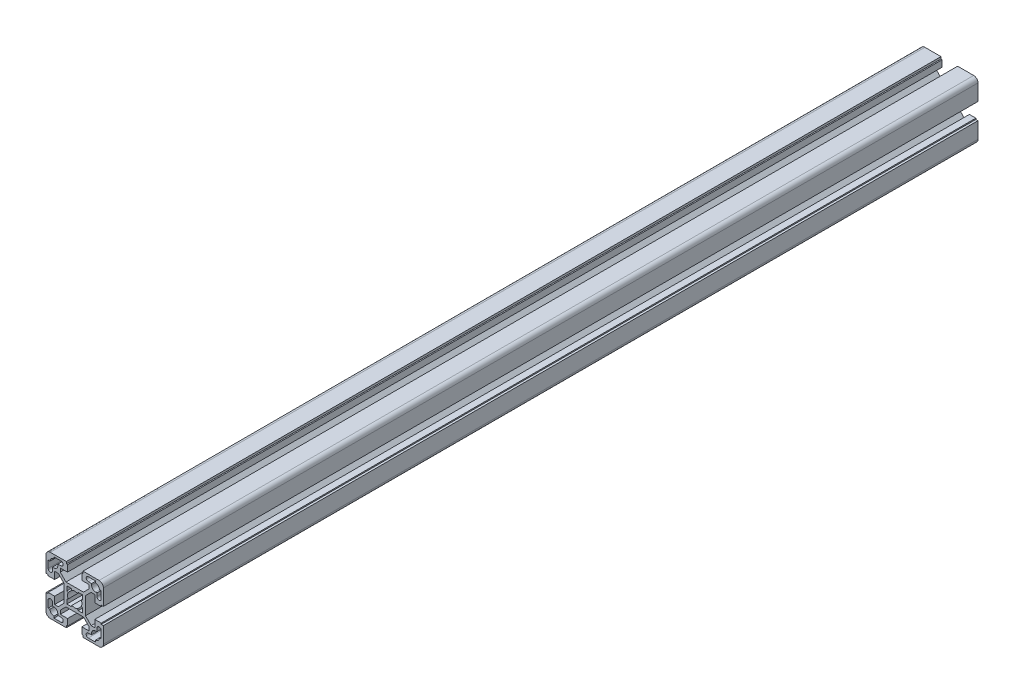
SolidWorks part; units mm, degrees
ref_plane "Front" through (0, 0, 0) normal (0, 0, 1) x (1, 0, 0)
ref_plane "Top" through (0, 0, 0) normal (0, 1, 0) x (1, 0, 0)
ref_plane "Right" through (0, 0, 0) normal (1, 0, 0) x (0, 0, -1)
ref_plane "Plane1" through (0, 0, 25) normal (0, 0, 1) x (1, 0, 0)
sketch "Sketch1" plane through (0, 0, 25) normal (0, 0, 1) x (1, 0, 0)
  line L0 (-17.25, -14.5) -> (-18.5, -14.5)
  line L1 (-18.5, -14.5) -> (-18.5, -9.5)
  line L2 (-15.5, -9.5) -> (-15.5, -11.75)
  line L3 (-15.5, -11.75) -> (-14.5, -11.75)
  line L4 (-11.75, -14.5) -> (-11.75, -15.5)
  line L5 (-11.75, -15.5) -> (-9.5, -15.5)
  line L6 (-9.5, -18.5) -> (-14.5, -18.5)
  line L7 (-14.5, -18.5) -> (-14.5, -17.25)
  line L8 (9.5, -15.5) -> (11.75, -15.5)
  line L9 (11.75, -15.5) -> (11.75, -14.5)
  line L10 (14.5, -11.75) -> (15.5, -11.75)
  line L11 (15.5, -11.75) -> (15.5, -9.5)
  line L12 (18.5, -9.5) -> (18.5, -14.5)
  line L13 (18.5, -14.5) -> (17.25, -14.5)
  line L14 (14.5, -17.25) -> (14.5, -18.5)
  line L15 (14.5, -18.5) -> (9.5, -18.5)
  line L16 (17.25, 14.5) -> (18.5, 14.5)
  line L17 (18.5, 14.5) -> (18.5, 9.5)
  line L18 (15.5, 9.5) -> (15.5, 11.75)
  line L19 (15.5, 11.75) -> (14.5, 11.75)
  line L20 (11.75, 14.5) -> (11.75, 15.5)
  line L21 (11.75, 15.5) -> (9.5, 15.5)
  line L22 (9.5, 18.5) -> (14.5, 18.5)
  line L23 (14.5, 18.5) -> (14.5, 17.25)
  line L24 (-9.5, 15.5) -> (-11.75, 15.5)
  line L25 (-11.75, 15.5) -> (-11.75, 14.5)
  line L26 (-14.5, 11.75) -> (-15.5, 11.75)
  line L27 (-15.5, 11.75) -> (-15.5, 9.5)
  line L28 (-18.5, 9.5) -> (-18.5, 14.5)
  line L29 (-18.5, 14.5) -> (-17.25, 14.5)
  line L30 (-14.5, 17.25) -> (-14.5, 18.5)
  line L31 (-14.5, 18.5) -> (-9.5, 18.5)
  line L32 (-2.3979, -5.5) -> (-5.5, -5.5)
  line L33 (-5.5, -5.5) -> (-5.5, -2.3979)
  line L34 (-5.5, -2.3979) -> (-4.5833, -1.9983)
  line L35 (-4.5833, 1.9983) -> (-5.5, 2.3979)
  line L36 (-5.5, 2.3979) -> (-5.5, 5.5)
  line L37 (-5.5, 5.5) -> (-2.3979, 5.5)
  line L38 (-2.3979, 5.5) -> (-1.9983, 4.5833)
  line L39 (1.9983, 4.5833) -> (2.3979, 5.5)
  line L40 (2.3979, 5.5) -> (5.5, 5.5)
  line L41 (5.5, 5.5) -> (5.5, 2.3979)
  line L42 (5.5, 2.3979) -> (4.5833, 1.9983)
  line L43 (4.5833, -1.9983) -> (5.5, -2.3979)
  line L44 (5.5, -2.3979) -> (5.5, -5.5)
  line L45 (5.5, -5.5) -> (2.3979, -5.5)
  line L46 (2.3979, -5.5) -> (1.9983, -4.5833)
  line L47 (-1.9983, -4.5833) -> (-2.3979, -5.5)
  line L48 (10.05, -11.4642) -> (10.05, -14)
  line L49 (10.05, -14) -> (5, -14)
  line L50 (5, -14) -> (5, -18.5)
  line L51 (5, -18.5) -> (5.8, -18.5)
  line L52 (5.8, -18.5) -> (5.8, -20)
  line L53 (5.8, -20) -> (17, -20)
  line L54 (20, -17) -> (20, -5.8)
  line L55 (20, -5.8) -> (18.5, -5.8)
  line L56 (18.5, -5.8) -> (18.5, -5)
  line L57 (18.5, -5) -> (14, -5)
  line L58 (14, -5) -> (14, -10.05)
  line L59 (14, -10.05) -> (11.4642, -10.05)
  line L60 (11.4642, -10.05) -> (7.5, -6.0858)
  line L61 (7.5, -6.0858) -> (7.5, 6.0858)
  line L62 (7.5, 6.0858) -> (11.4642, 10.05)
  line L63 (11.4642, 10.05) -> (14, 10.05)
  line L64 (14, 10.05) -> (14, 5)
  line L65 (14, 5) -> (18.5, 5)
  line L66 (18.5, 5) -> (18.5, 5.8)
  line L67 (18.5, 5.8) -> (20, 5.8)
  line L68 (20, 5.8) -> (20, 17)
  line L69 (17, 20) -> (5.8, 20)
  line L70 (5.8, 20) -> (5.8, 18.5)
  line L71 (5.8, 18.5) -> (5, 18.5)
  line L72 (5, 18.5) -> (5, 14)
  line L73 (5, 14) -> (10.05, 14)
  line L74 (10.05, 14) -> (10.05, 11.4642)
  line L75 (10.05, 11.4642) -> (6.0858, 7.5)
  line L76 (6.0858, 7.5) -> (-6.0858, 7.5)
  line L77 (-6.0858, 7.5) -> (-10.05, 11.4642)
  line L78 (-10.05, 11.4642) -> (-10.05, 14)
  line L79 (-10.05, 14) -> (-5, 14)
  line L80 (-5, 14) -> (-5, 18.5)
  line L81 (-5, 18.5) -> (-5.8, 18.5)
  line L82 (-5.8, 18.5) -> (-5.8, 20)
  line L83 (-5.8, 20) -> (-17, 20)
  line L84 (-20, 17) -> (-20, 5.8)
  line L85 (-20, 5.8) -> (-18.5, 5.8)
  line L86 (-18.5, 5.8) -> (-18.5, 5)
  line L87 (-18.5, 5) -> (-14, 5)
  line L88 (-14, 5) -> (-14, 10.05)
  line L89 (-14, 10.05) -> (-11.4642, 10.05)
  line L90 (-11.4642, 10.05) -> (-7.5, 6.0858)
  line L91 (-7.5, 6.0858) -> (-7.5, -6.0858)
  line L92 (-7.5, -6.0858) -> (-11.4642, -10.05)
  line L93 (-11.4642, -10.05) -> (-14, -10.05)
  line L94 (-14, -10.05) -> (-14, -5)
  line L95 (-14, -5) -> (-18.5, -5)
  line L96 (-18.5, -5) -> (-18.5, -5.8)
  line L97 (-18.5, -5.8) -> (-20, -5.8)
  line L98 (-20, -5.8) -> (-20, -17)
  line L99 (-17, -20) -> (-5.8, -20)
  line L100 (-5.8, -20) -> (-5.8, -18.5)
  line L101 (-5.8, -18.5) -> (-5, -18.5)
  line L102 (-5, -18.5) -> (-5, -14)
  line L103 (-5, -14) -> (-10.05, -14)
  line L104 (-10.05, -14) -> (-10.05, -11.4642)
  line L105 (-10.05, -11.4642) -> (-6.0858, -7.5)
  line L106 (-6.0858, -7.5) -> (6.0858, -7.5)
  line L107 (6.0858, -7.5) -> (10.05, -11.4642)
  arc A0 (-14.5, -17.25) -> (-17.25, -14.5) centre (-14.5, -14.5) cw
  arc A1 (-18.5, -9.5) -> (-15.5, -9.5) centre (-17, -9.5) cw
  arc A2 (-14.5, -11.75) -> (-11.75, -14.5) centre (-14.5, -14.5) cw
  arc A3 (-9.5, -15.5) -> (-9.5, -18.5) centre (-9.5, -17) cw
  arc A4 (9.5, -18.5) -> (9.5, -15.5) centre (9.5, -17) cw
  arc A5 (11.75, -14.5) -> (14.5, -11.75) centre (14.5, -14.5) cw
  arc A6 (15.5, -9.5) -> (18.5, -9.5) centre (17, -9.5) cw
  arc A7 (17.25, -14.5) -> (14.5, -17.25) centre (14.5, -14.5) cw
  arc A8 (14.5, 17.25) -> (17.25, 14.5) centre (14.5, 14.5) cw
  arc A9 (18.5, 9.5) -> (15.5, 9.5) centre (17, 9.5) cw
  arc A10 (14.5, 11.75) -> (11.75, 14.5) centre (14.5, 14.5) cw
  arc A11 (9.5, 15.5) -> (9.5, 18.5) centre (9.5, 17) cw
  arc A12 (-9.5, 18.5) -> (-9.5, 15.5) centre (-9.5, 17) cw
  arc A13 (-11.75, 14.5) -> (-14.5, 11.75) centre (-14.5, 14.5) cw
  arc A14 (-15.5, 9.5) -> (-18.5, 9.5) centre (-17, 9.5) cw
  arc A15 (-17.25, 14.5) -> (-14.5, 17.25) centre (-14.5, 14.5) cw
  arc A16 (-4.5833, -1.9983) -> (-4.5833, 1.9983) centre (0, 0) cw
  arc A17 (-1.9983, 4.5833) -> (1.9983, 4.5833) centre (0, 0) cw
  arc A18 (4.5833, 1.9983) -> (4.5833, -1.9983) centre (0, 0) cw
  arc A19 (1.9983, -4.5833) -> (-1.9983, -4.5833) centre (0, 0) cw
  arc A20 (17, -20) -> (20, -17) centre (17, -17) ccw
  arc A21 (20, 17) -> (17, 20) centre (17, 17) ccw
  arc A22 (-17, 20) -> (-20, 17) centre (-17, 17) ccw
  arc A23 (-20, -17) -> (-17, -20) centre (-17, -17) ccw
extrude "Boss-Extrude1" add sketch "Sketch1" against normal blind 609.6
